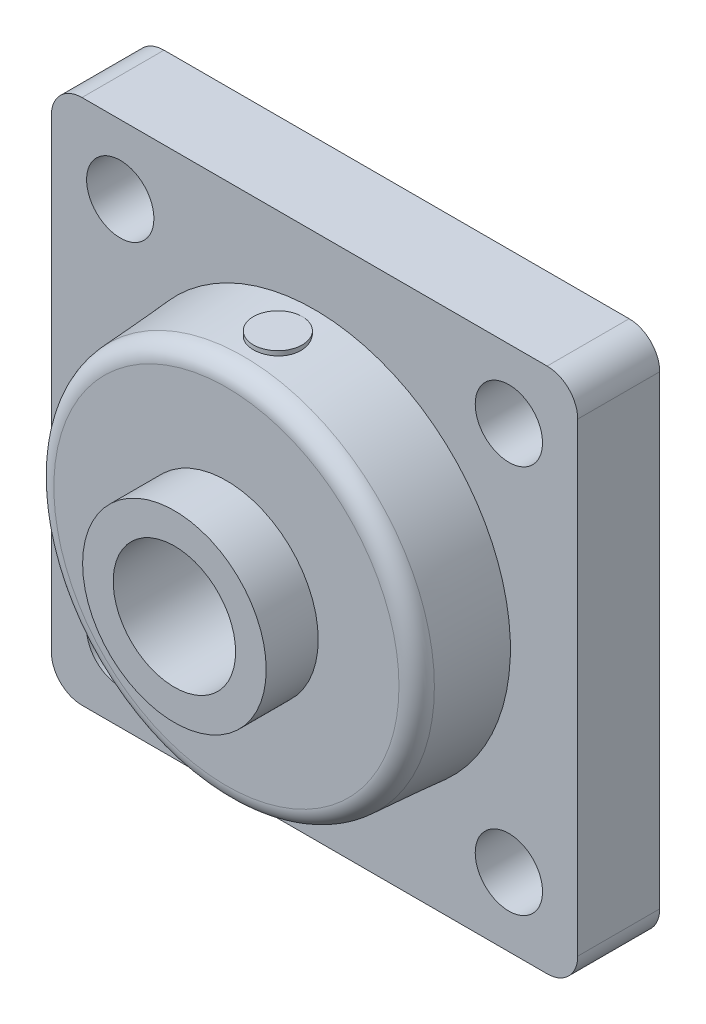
SolidWorks part; units mm, degrees
ref_plane "Plan de face" through (0, 0, 0) normal (0, 0, 1) x (1, 0, 0)
ref_plane "Plan de dessus" through (0, 0, 0) normal (0, 1, 0) x (1, 0, 0)
ref_plane "Plan de droite" through (0, 0, 0) normal (1, 0, 0) x (0, 0, -1)
sketch "Esquisse1" plane through (0, 0, 0) normal (0, 0, 1) x (1, 0, 0)
  line L0 (0, 43) -> (0, -43) construction
  line L1 (-38, -43) -> (38, -43)
  line L2 (-43, -38) -> (-43, 38)
  line L3 (-38, 43) -> (38, 43)
  line L4 (43, -38) -> (43, 38)
  arc A0 (-38, 43) -> (-43, 38) centre (-38, 38) ccw
  arc A1 (38, 43) -> (43, 38) centre (38, 38) cw
  arc A2 (-43, -38) -> (-38, -43) centre (-38, -38) ccw
  arc A3 (43, -38) -> (38, -43) centre (38, -38) cw
  circle A4 centre (-31.75, 31.75) radius 5.5
  circle A5 centre (31.75, 31.75) radius 5.5
  circle A6 centre (-31.75, -31.75) radius 5.5
  circle A7 centre (31.75, -31.75) radius 5.5
  dimension "D2" = 86
  dimension "D3" = 43
  dimension "D4" = 43
  dimension "D6" = 5
  dimension "D7" = 11
  dimension "D8" = 76
  dimension "D9" = 63.5
  dimension "D1" = 86
  dimension "D5" = 76
  dimension "D10" = 11.25
  dimension "D11" = 63.5
extrude "Extrusion1" add sketch "Esquisse1" along normal blind 13.4
sketch "Esquisse2" plane through (0, 0, 13.4) normal (0, 0, 1) x (1, 0, 0)
  circle A0 centre (0, 0) radius 32
  dimension "D1" = 64
extrude "Extrusion2" add sketch "Esquisse2" along normal blind 14.4 draft 4
fillet "Congé1" radius 3 1 edges at (30.9931, 0, 27.8)
sketch "Esquisse3" plane through (0, 0, 27.8) normal (0, 0, 1) x (1, 0, 0)
  circle A0 centre (0, 0) radius 15
  dimension "D2" = 30
extrude "Extrusion3" add sketch "Esquisse3" along normal blind 8.5
ref_plane "Plan3" through (0, 0, 0) normal (-0.7071, 0.7071, 0) x (0, 0, 1)
sketch "Esquisse6" plane through (0, 0, 0) normal (0, 1, 0) x (0, 0, 1)
  line L1 (13.4, 0) -> (25.0093, 0) construction
  circle A0 centre (19.4, 0) radius 4
  dimension "D1" = 8
  dimension "D2" = 6
extrude "Extrusion4" add sketch "Esquisse6" along normal blind 32
sketch "Esquisse4" plane through (0, 0, 36.3) normal (0, 0, 1) x (1, 0, 0)
  circle A0 centre (0, 0) radius 10
  dimension "D1" = 20
extrude "Enlèv. mat.-Extru.1" cut sketch "Esquisse4" against normal through all
